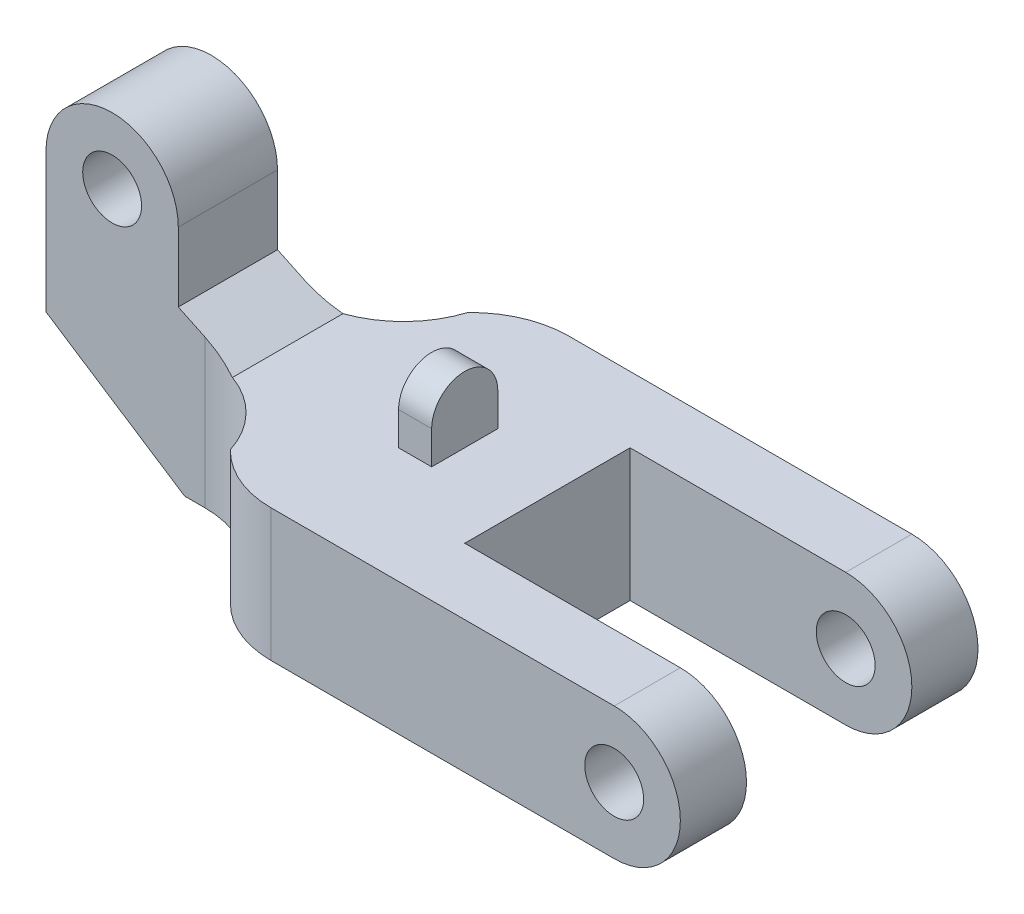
SolidWorks part; units mm, degrees
ref_plane "Front Plane" through (0, 0, 0) normal (0, 0, 1) x (1, 0, 0)
ref_plane "Top Plane" through (0, 0, 0) normal (0, 1, 0) x (1, 0, 0)
ref_plane "Right Plane" through (0, 0, 0) normal (1, 0, 0) x (0, 0, -1)
sketch "Sketch1" plane through (0, 0, 0) normal (0, 0, 1) x (1, 0, 0)
  line L0 (-37.0187, 0) -> (-37.0187, -7)
  line L1 (-37.0187, -7) -> (-32.828, -9.7272)
  line L2 (-32.828, -9.7272) -> (-14.058, -9.7272)
  line L3 (-14.058, -9.7272) -> (-14.058, -5.7272)
  line L4 (-14.058, -5.7272) -> (-31.2112, -5.7272)
  line L5 (-37.0187, 0) -> (-33.0187, 0)
  line L6 (-33.0187, 0) -> (-33.0187, -4.8711)
  line L7 (-33.0187, -4.8711) -> (-31.2112, -5.7272)
  line L8 (-35.0187, 0) -> (-35.0187, -2.78) construction
  line L9 (-35.0187, -2.78) -> (-23.8008, -2.78) construction
  line L10 (-23.8008, -2.78) -> (-23.8008, -7.7272) construction
  line L11 (-14.058, -7.7272) -> (-16.838, -7.7272) construction
  line L12 (-23.8008, -7.7272) -> (-16.838, -7.7272) construction
  circle A0 centre (-16.838, -7.7272) radius 0.89
  circle A1 centre (-35.0187, -2.78) radius 0.89
  arc A2 (-33.0187, -2.78) -> (-37.0187, -2.78) centre (-35.0187, -2.78) ccw
  dimension "D5" = 1.78
  dimension "D7" = 1.78
  dimension "D1" = 4
  dimension "D2" = 7
  dimension "D3" = 4
  dimension "D4" = 2.78
  dimension "D6" = 2
  dimension "D8" = 5
  dimension "D9" = 18.77
extrude "Boss-Extrude1" add sketch "Sketch1" along normal blind 9
sketch "Sketch3" plane through (0, -5.7272, 0) normal (0, 1, 0) x (1, 0, 0)
  line L0 (-14.058, -9) -> (-14.058, 0) construction
  line L1 (-14.058, -7) -> (-14.058, -2)
  line L2 (-14.058, -7) -> (-23.358, -7)
  line L3 (-14.058, -2) -> (-23.358, -2)
  line L4 (-23.358, -2) -> (-23.358, -7)
  point P7 (-14.058, -4.5)
  dimension "D1" = 5
  dimension "D2" = 9.3
extrude "Cut-Extrude1" cut sketch "Sketch3" against normal blind 9
sketch "Sketch4" plane through (0, 0, 9) normal (0, 0, 1) x (1, 0, 0)
  line L0 (-16.838, -7.7272) -> (-16.838, -5.7272) construction
  line L1 (-14.058, -5.7272) -> (-31.2112, -5.7272) construction
  line L2 (-16.838, -5.7272) -> (-16.838, -9.7272) construction
  line L3 (-32.828, -9.7272) -> (-14.058, -9.7272) construction
  line L4 (-16.838, -5.7272) -> (-14.058, -5.7272)
  line L5 (-14.058, -5.7272) -> (-14.058, -9.7272)
  line L6 (-14.058, -9.7272) -> (-16.838, -9.7272)
  arc A0 (-16.838, -9.7272) -> (-16.838, -5.7272) centre (-16.838, -7.7272) ccw
extrude "Cut-Extrude2" cut sketch "Sketch4" against normal blind 10
sketch "Sketch6" plane through (0, -5.7272, 0) normal (0, 1, 0) x (1, 0, 0)
  line L0 (-23.358, -4.5) -> (-26.358, -4.5) construction
  line L1 (-23.358, -2) -> (-23.358, -7) construction
  line L3 (-25.858, -5.5) -> (-26.858, -5.5)
  line L4 (-25.858, -5.5) -> (-25.858, -3.5)
  line L5 (-25.858, -3.5) -> (-26.858, -3.5)
  line L6 (-26.858, -5.5) -> (-26.858, -3.5)
  line L7 (-25.858, -5.5) -> (-26.858, -3.5) construction
  line L8 (-25.858, -3.5) -> (-26.858, -5.5) construction
  dimension "D1" = 3
  dimension "D2" = 1
  dimension "D3" = 2
extrude "Boss-Extrude2" add sketch "Sketch6" along normal blind 2
sketch "Sketch7" plane through (-25.858, 0, 0) normal (1, 0, 0) x (0, 0, -1)
  line L0 (-5.5, -4.7272) -> (-5.5, -3.7272) construction
  line L1 (-5.5, -3.7272) -> (-5.5, -5.7272) construction
  line L2 (-5.5, -3.7272) -> (-3.5, -3.7272) construction
  line L3 (-3.5, -3.7272) -> (-3.5, -4.7272) construction
  line L4 (-3.5, -3.7272) -> (-3.5, -5.7272) construction
  arc A0 (-5.5, -4.7272) -> (-3.5, -4.7272) centre (-4.5, -4.7272) cw
extrude "Cut-Extrude3" cut sketch "Sketch7" against normal blind 2 and the other way through all
sketch "Sketch9" plane through (0, 0, 0) normal (0, 0, -1) x (-1, 0, 0)
  line L0 (31.2112, -5.7272) -> (33.0187, -4.8711)
  line L1 (33.0187, -4.8711) -> (33.0187, -2.78)
  line L2 (37.0187, -2.78) -> (37.0187, -7)
  line L3 (37.0187, -7) -> (32.828, -9.7272)
  line L4 (32.828, -9.7272) -> (31.2112, -9.7272)
  line L5 (32.828, -9.7272) -> (16.838, -9.7272) construction
  line L6 (31.2112, -9.7272) -> (31.2112, -5.7272)
  arc A0 (33.0187, -2.78) -> (37.0187, -2.78) centre (35.0187, -2.78) cw
  circle A1 centre (35.0187, -2.78) radius 0.89
extrude "Cut-Extrude5" cut sketch "Sketch9" against normal blind 3
sketch "Sketch10" plane through (0, 0, 9) normal (0, 0, 1) x (1, 0, 0)
  line L0 (-31.2112, -5.7272) -> (-33.0187, -4.8711)
  line L1 (-33.0187, -4.8711) -> (-33.0187, -2.78)
  line L2 (-37.0187, -2.78) -> (-37.0187, -7)
  line L3 (-37.0187, -7) -> (-32.828, -9.7272)
  line L4 (-32.828, -9.7272) -> (-31.2112, -9.7272)
  line L5 (-31.2112, -9.7272) -> (-31.2112, -5.7272)
  arc A0 (-33.0187, -2.78) -> (-37.0187, -2.78) centre (-35.0187, -2.78) ccw
extrude "Cut-Extrude6" cut sketch "Sketch10" against normal blind 3
sketch "Sketch12" plane through (0, -5.7272, 0) normal (0, 1, 0) x (1, 0, 0)
  line L0 (-16.838, -9) -> (-31.2112, -9) construction
  line L1 (-31.2112, -6) -> (-29.2112, -6)
  line L2 (-31.2112, -6) -> (-31.2112, -9)
  line L3 (-31.2112, -9) -> (-29.2112, -9)
  line L4 (-29.2112, -6) -> (-29.2112, -9)
  line L5 (-16.838, 0) -> (-31.2112, 0) construction
  line L6 (-31.2112, -3) -> (-29.2112, -3)
  line L7 (-31.2112, -3) -> (-31.2112, 0)
  line L8 (-31.2112, 0) -> (-29.2112, 0)
  line L9 (-29.2112, -3) -> (-29.2112, 0)
  dimension "D1" = 2
  dimension "D2" = 2
extrude "Cut-Extrude7" cut sketch "Sketch12" against normal blind 5
fillet "Fillet1" radius 3 2 edges at (-29.2112, -7.7272, 3) (-29.2112, -7.7272, 6)
sketch "Sketch13" plane through (0, -5.7272, 0) normal (0, 1, 0) x (1, 0, 0)
  line L0 (-29.2112, -9) -> (-27.2112, -9)
  line L1 (-16.838, -9) -> (-29.2112, -9) construction
  line L2 (-29.2112, 0) -> (-27.2112, 0)
  line L3 (-16.838, 0) -> (-29.2112, 0) construction
  arc A0 (-27.2112, -9) -> (-29.3521, -8.0913) centre (-27.2112, -6.0236) cw
  arc A2 (-27.2112, 0) -> (-29.3521, -0.9087) centre (-27.2112, -2.9764) ccw
  arc A4 (-29.2112, -9) -> (-29.3521, -8.0913) centre (-32.2112, -9) ccw
  arc A5 (-29.2112, 0) -> (-29.3521, -0.9087) centre (-32.2112, 0) cw
extrude "Cut-Extrude8" cut sketch "Sketch13" against normal blind 5
